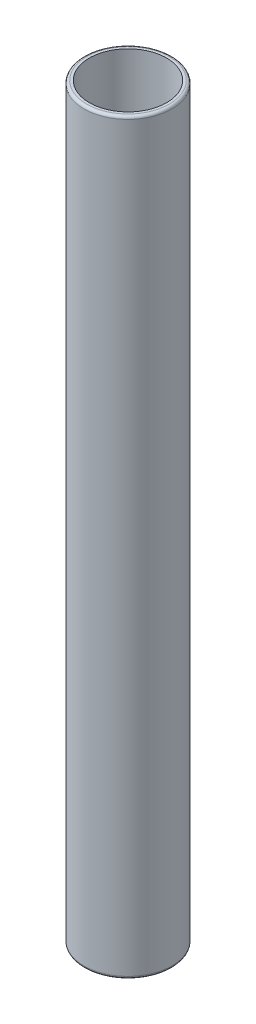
SolidWorks part; units mm, degrees
ref_plane "Front Plane" through (0, 0, 0) normal (0, 0, 1) x (1, 0, 0)
ref_plane "Top Plane" through (0, 0, 0) normal (0, 1, 0) x (1, 0, 0)
ref_plane "Right Plane" through (0, 0, 0) normal (1, 0, 0) x (0, 0, -1)
sketch "Sketch1" plane through (0, 0, 0) normal (0, 1, 0) x (1, 0, 0)
  circle A0 centre (0, 0) radius 3.175
  circle A1 centre (0, 0) radius 2.794
  dimension "D1" = 5.588
  dimension "D2" = 6.35
extrude "Boss-Extrude1" add sketch "Sketch1" along normal blind 53.975
fillet "Fillet1" radius 0.1984 2 edges at (0, 0, 3.175) (0, 53.975, 3.175)
